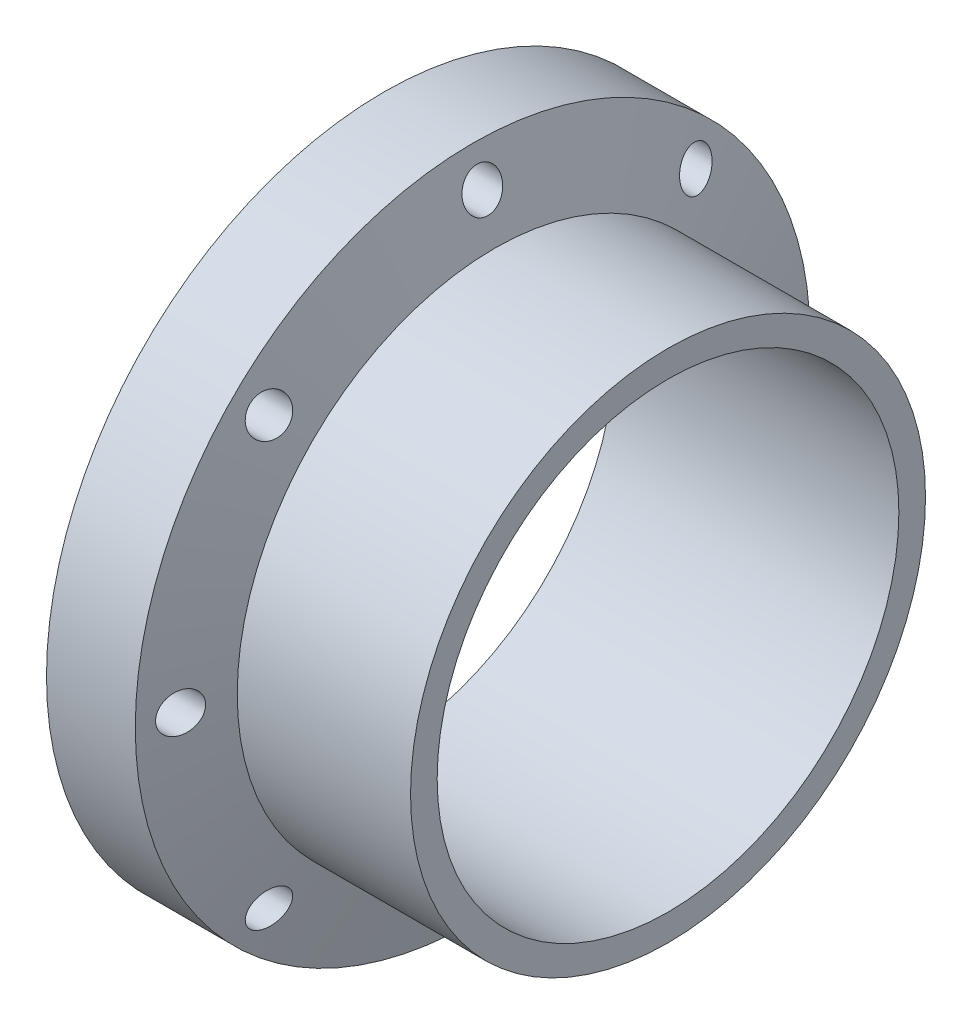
SolidWorks part; units mm, degrees
ref_plane "Front" through (0, 0, 0) normal (0, 0, 1) x (1, 0, 0)
ref_plane "Top" through (0, 0, 0) normal (0, 1, 0) x (1, 0, 0)
ref_plane "Right" through (0, 0, 0) normal (1, 0, 0) x (0, 0, -1)
sketch "Sketch1" plane through (0, 0, 0) normal (0, 0, 1) x (1, 0, 0)
  line L0 (112.8183, 23.0187) -> (97.3275, 23.0187)
  line L1 (97.3275, 23.0187) -> (95.3558, 30.1625)
  line L2 (95.3558, 30.1625) -> (93.7683, 30.1625)
  line L3 (93.7683, 30.1625) -> (93.7683, 20.6375)
  line L4 (93.7683, 20.6375) -> (112.8183, 20.6375)
  line L5 (112.8183, 20.6375) -> (112.8183, 23.0187)
  line L6 (125.7203, 0) -> (80.8924, 0) construction
  arc A0 (97.2958, 23.1521) -> (22.225, 97.5118) centre (0, 0) ccw construction
  dimension "D1" = 41.275
  dimension "D2" = 46.0375
  dimension "D3" = 19.05
  dimension "D4" = 60.325
  dimension "D5" = 1.5875
revolve "Revolve1" add sketch "Sketch1" angle 360 about L6
sketch "Sketch2" plane through (93.7683, 0, 0) normal (-1, 0, 0) x (0, 0, 1)
  circle A0 centre (0, 0) radius 20.6375 construction
  circle A1 centre (0, 0) radius 30.1625
  circle A2 centre (0, 0) radius 30.1625
  circle A3 centre (0, 0) radius 20.6375
  dimension "D1" = 0
extrude "Extrude1" add sketch "Sketch2" along normal blind 6.35
hole_wizard "#6-32 Tapped Hole1" positions "Sketch4" profile "Sketch3" tap size "#6-32" standard "Ansi Inch"
sketch "Sketch4" plane through (87.4183, 0, 0) normal (-1, 0, 0) x (0, 0, 1)
  line L2 (0, 0) -> (0, 26.9875)
  circle A0 centre (0, 26.9875) radius 2.1526 construction
  point P0 (-26.9875, 0)
  point P1 (-19.083, -19.083)
  point P4 (0, -26.9875)
  point P8 (19.083, -19.083)
  point P11 (26.9875, 0)
  point P14 (19.083, 19.083)
  point P17 (0, 26.9875)
  point P21 (-19.083, 19.083)
  dimension "D1" = 26.9875
  dimension "D2" = 26.9875
sketch "Sketch3" plane through (87.4183, 0, -26.9875) normal (0, 1, 0) x (0, 0, 1)
  line L0 (0, 0) -> (0, 8.8138)
  line L1 (0, 8.8138) -> (1.7526, 8.8138)
  line L2 (1.7526, 8.8138) -> (1.7526, 0)
  line L5 (1.7526, 0) -> (0, 0)
  line L11 (0, -6.35) -> (0, 107.95) construction
  dimension "Thread Major Dia." = 3.5052
  dimension "Thru Tap Drill Depth" = 8.8138
